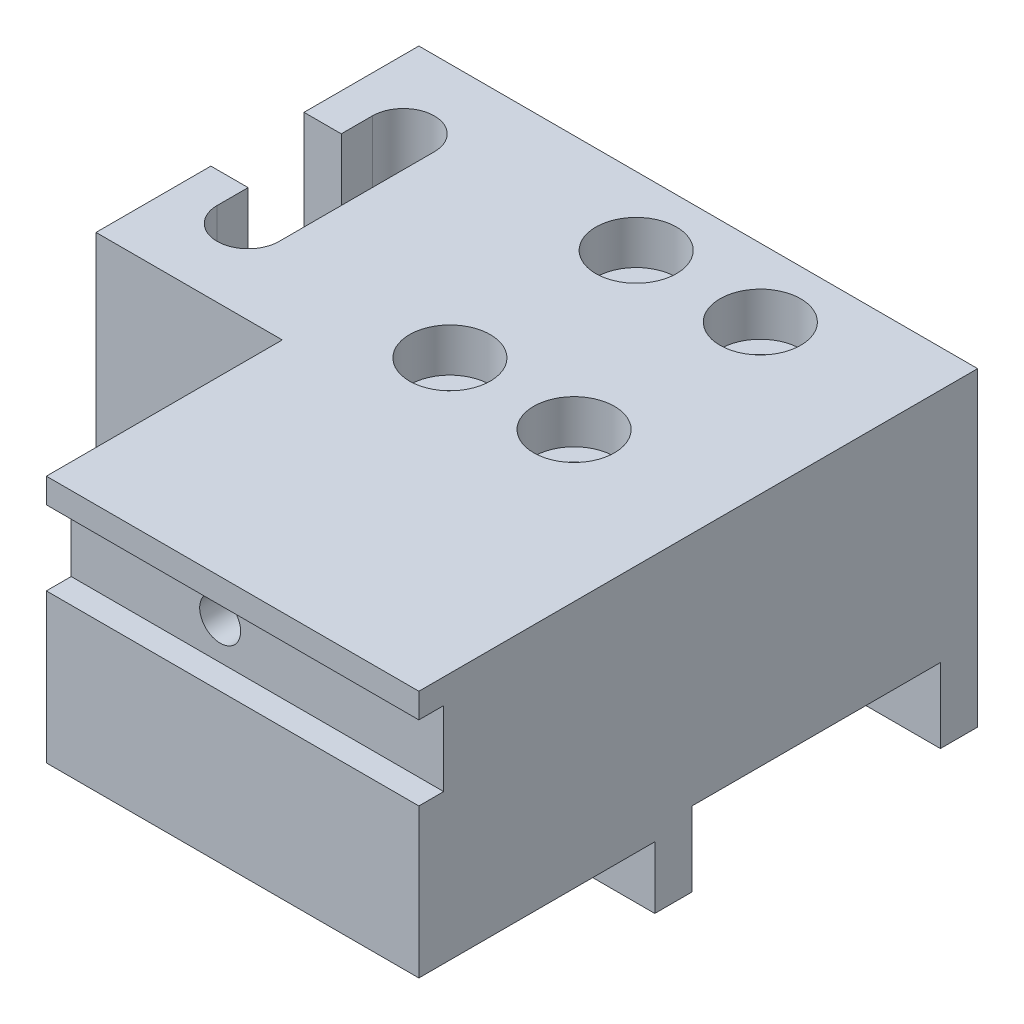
SolidWorks part; units mm, degrees
ref_plane "前视基准面" through (0, 0, 0) normal (0, 0, 1) x (1, 0, 0)
ref_plane "上视基准面" through (0, 0, 0) normal (0, 1, 0) x (1, 0, 0)
ref_plane "右视基准面" through (0, 0, 0) normal (1, 0, 0) x (0, 0, -1)
sketch "草图1" plane through (0, 0, 0) normal (0, 0, 1) x (1, 0, 0)
  line L0 (15, 0) -> (15, 6)
  line L1 (45, 0) -> (45, 25)
  line L2 (0, 6) -> (0, 25)
  line L3 (0, 25) -> (45, 25)
  line L4 (15, 0) -> (45, 0)
  line L5 (15, 6) -> (0, 6)
extrude "凸台-拉伸1" add sketch "草图1" along normal blind 45
sketch "草图2" plane through (45, 0, 0) normal (1, 0, 0) x (0, 0, -1)
  line L0 (-45, 25) -> (0, 25)
  line L1 (-45, 5) -> (-26, 5)
  line L2 (-45, 5) -> (-45, 17)
  line L3 (-43, 17) -> (-43, 23)
  line L4 (0, 0) -> (0, 25)
  line L5 (-45, 23) -> (-43, 23)
  line L6 (-45, 17) -> (-43, 17)
  line L7 (-45, 23) -> (-45, 25)
  line L8 (-23, 0) -> (-23, 6)
  line L9 (-3, 0) -> (-3, 6)
  line L10 (-23, 6) -> (-3, 6)
  line L11 (-3, 0) -> (0, 0)
  line L12 (-26, 0) -> (-23, 0)
  line L13 (-26, 5) -> (-26, 0)
extrude "切除-拉伸1" cut sketch "草图2" against normal blind 45 flip side to cut
sketch "草图3" plane through (45, 0, 0) normal (1, 0, 0) x (0, 0, -1)
  circle A0 centre (-31, 11) radius 1.65
  circle A1 centre (-40, 11) radius 1.65
sketch "草图4" plane through (0, 0, 0) normal (-1, 0, 0) x (0, 0, 1)
  circle A0 centre (31, 11) radius 1.65
  circle A1 centre (40, 11) radius 1.65
extrude "切除-拉伸2" cut sketch "草图4" against normal blind 15
sketch "草图5" plane through (0, 0, 43) normal (0, 0, 1) x (1, 0, 0)
  circle A0 centre (27, 20) radius 1.65
extrude "切除-拉伸3" cut sketch "草图5" against normal blind 15
sketch "草图6" plane through (0, 25, 0) normal (0, 1, 0) x (1, 0, 0)
  line L0 (45, -45) -> (45, 0)
  line L1 (15, -45) -> (15, -26)
  line L2 (0, -26) -> (0, -16.75)
  line L3 (15, -45) -> (45, -45)
  line L4 (0, 0) -> (45, 0)
  line L5 (0, -26) -> (15, -26)
  line L6 (3, -19.25) -> (3, -16.75)
  line L7 (8, -19.25) -> (8, -6.75)
  line L8 (0, -9.25) -> (3, -9.25)
  line L9 (0, -16.75) -> (3, -16.75)
  line L10 (3, -9.25) -> (3, -6.75)
  line L11 (0, -9.25) -> (0, 0)
  circle A0 centre (23, -5.5) radius 1.75
  circle A1 centre (33, -5.5) radius 1.75
  circle A2 centre (33, -20.5) radius 1.75
  circle A3 centre (23, -20.5) radius 1.75
  arc A4 (3, -19.25) -> (8, -19.25) centre (5.5, -19.25) ccw
  arc A5 (8, -6.75) -> (3, -6.75) centre (5.5, -6.75) ccw
extrude "切除-拉伸4" cut sketch "草图6" against normal through all flip side to cut
sketch "草图7" plane through (0, 25, 0) normal (0, 1, 0) x (1, 0, 0)
  circle A0 centre (23, -5.5) radius 3.25
  circle A1 centre (33, -5.5) radius 3.25
  circle A2 centre (33, -20.5) radius 3.25
  circle A3 centre (23, -20.5) radius 3.25
extrude "切除-拉伸5" cut sketch "草图7" against normal blind 3.5
sketch "草图8" plane through (45, 0, 0) normal (1, 0, 0) x (0, 0, -1)
  circle A0 centre (-40, 11) radius 1.65
  circle A1 centre (-31, 11) radius 1.65
sketch "草图9" plane through (15, 0, 0) normal (-1, 0, 0) x (0, 0, 1)
  circle A0 centre (31, 11) radius 1.65
  circle A1 centre (40, 11) radius 1.65
extrude "切除-拉伸6" cut sketch "草图9" against normal blind 4.5
